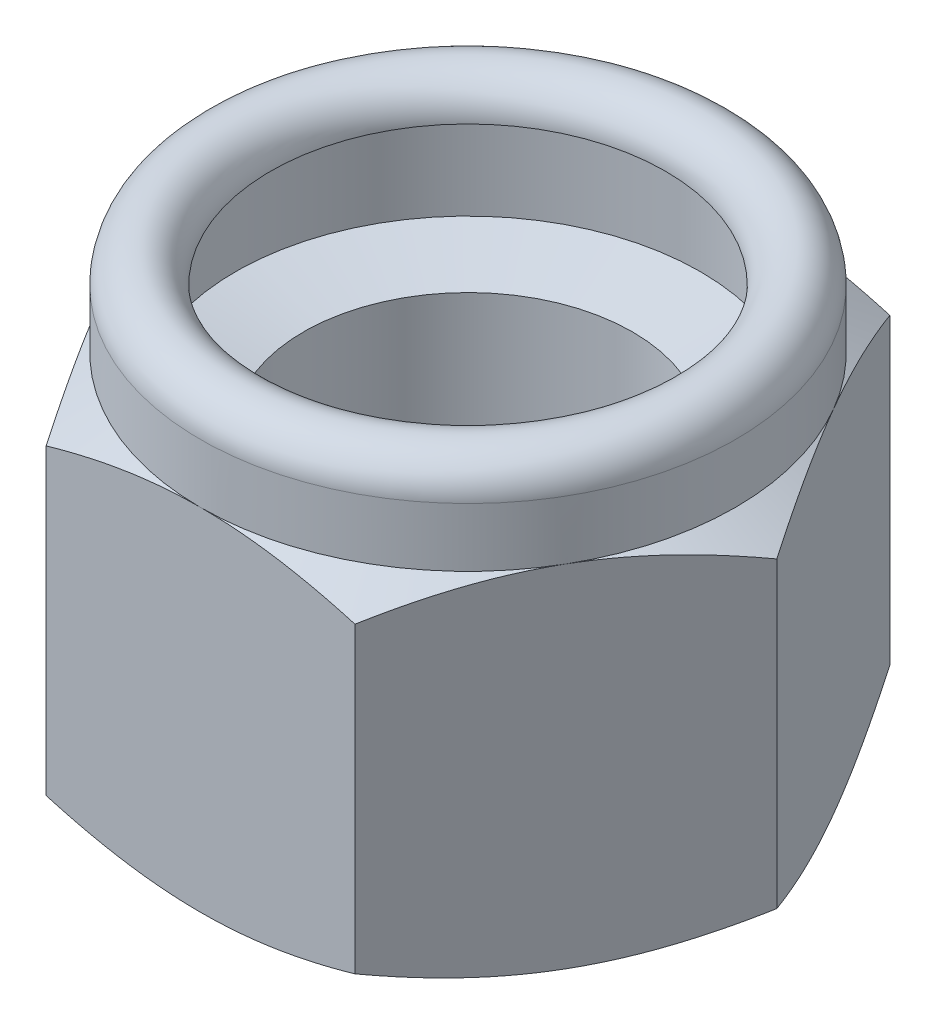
SolidWorks part; units mm, degrees
ref_plane "Plan1" through (0, 0, 0) normal (0, 0, 1) x (1, 0, 0)
ref_plane "Plan2" through (0, 0, 0) normal (0, 1, 0) x (1, 0, 0)
ref_plane "Plan3" through (0, 0, 0) normal (1, 0, 0) x (0, 0, -1)
sketch "Esquisse1" plane through (0, 0, 0) normal (0, 0, 1) x (1, 0, 0)
  line L1 (0, 10.8) -> (6.7778, 10.8) construction
  line L2 (4.8, 9.95) -> (5.65, 9.95)
  line L3 (9.1924, 6.9677) -> (9.1924, 1.5545)
  line L4 (9.1924, 1.5545) -> (6.5, 0)
  line L5 (4, 6.9677) -> (4, 0)
  line L7 (4, 0) -> (6.5, 0)
  line L8 (4, 6.9677) -> (5.65, 7.4099)
  line L9 (9.1924, 6.9677) -> (6.5, 8.5222)
  line L10 (6.5, 8.5222) -> (6.5, 9.95)
  line L11 (-4, 0) -> (4, 0) construction
  line L12 (-6.5, 0) -> (6.5, 0) construction
  line L13 (0, 0) -> (0, 10.8) construction
  line L15 (5.65, 9.95) -> (5.65, 7.4099)
  arc A0 (6.5, 9.95) -> (4.8, 9.95) centre (5.65, 9.95) ccw
revolve "Base-Révolution" add sketch "Esquisse1" angle 360 about L13
sketch "Esquisse2" plane through (0, 0, 0) normal (0, 1, 0) x (1, 0, 0)
  line L0 (0, 0) -> (0, 6.5) construction
  line L1 (0, 0) -> (9.1924, 0) construction
  line L2 (0, 0) -> (4.5962, 7.9608) construction
  line L3 (0, 0) -> (7.9608, 4.5962) construction
  line L4 (-3.7528, 6.5) -> (3.7528, 6.5)
  line L5 (3.7528, 6.5) -> (7.5056, 0)
  line L6 (3.7528, -6.5) -> (7.5056, 0)
  line L7 (-3.7528, -6.5) -> (3.7528, -6.5)
  line L8 (-3.7528, 6.5) -> (-7.5056, 0)
  line L9 (-3.7528, -6.5) -> (-7.5056, 0)
  circle A0 centre (0, 0) radius 6.5 construction
  circle A1 centre (0, 0) radius 9.1924 construction
  point P16 (0, -6.5)
  dimension "D1" = 30
  dimension "D2" = 30
extrude "Enlèv. mat.-Extru.2" cut sketch "Esquisse2" along normal through all flip side to cut
equation "\"D3@Esquisse1\" = \"Diamètre nominal@Esquisse1\"/2"
equation "\"D4@Esquisse1\" = \"Cote sur plats@Esquisse1\"/2"
equation "\"D1@Esquisse1\" = \"D4@Esquisse1\"/sqr(2)*2"
equation "\"D9@Esquisse1\" = \"D3@Esquisse1\"+(\"D3@Esquisse1\"*0.2)"
equation "\"D5@Esquisse1\" = \"Hauteur@Esquisse1\"/1.55"
